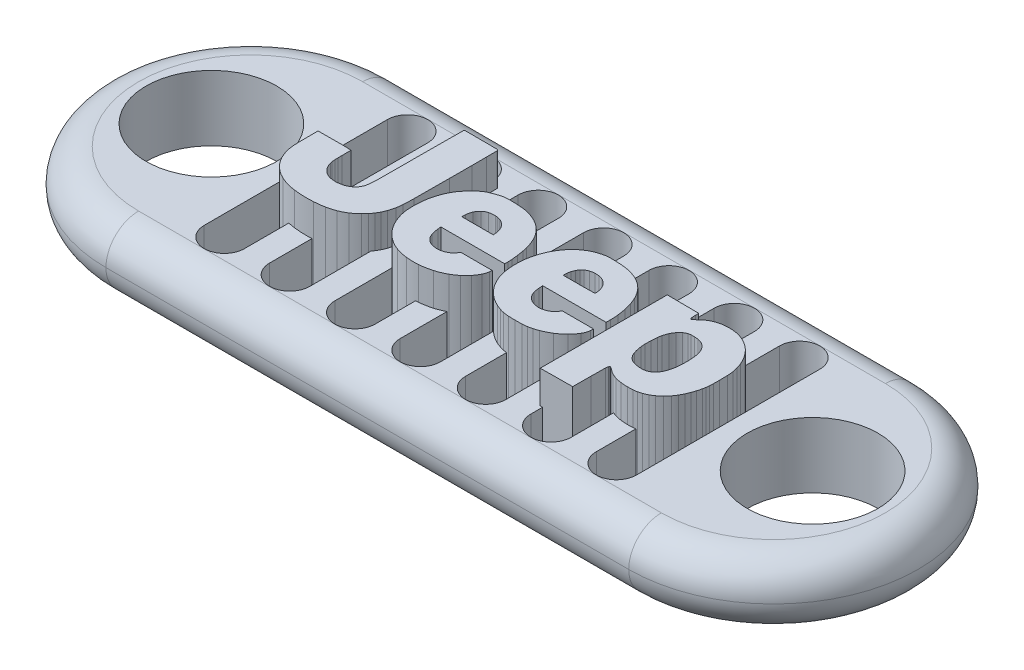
SolidWorks part; units mm, degrees
ref_plane "Front Plane" through (0, 0, 0) normal (0, 0, 1) x (1, 0, 0)
ref_plane "Top Plane" through (0, 0, 0) normal (0, 1, 0) x (1, 0, 0)
ref_plane "Right Plane" through (0, 0, 0) normal (1, 0, 0) x (0, 0, -1)
sketch "Sketch2" plane through (0, 0, 0) normal (0, 1, 0) x (1, 0, 0)
  line L0 (7.1989, 14.0654) -> (7.189, 13.0274)
  line L1 (4.2006, 7.7862) -> (4.2, 8.4725)
  line L2 (4.2, 8.4725) -> (4.01, 8.4933)
  line L3 (2.74, 8.507) -> (1.66, 8.5)
  line L4 (1.66, 8.5) -> (1.6621, 7.5)
  line L5 (9.8308, 13.2169) -> (9.8236, 14.0403)
  line L6 (17.5483, 5.7274) -> (17.5711, 5.92)
  line L7 (17.5711, 5.92) -> (16.371, 5.92)
  line L8 (16.371, 5.92) -> (15.1709, 5.92)
  line L9 (15.1709, 5.92) -> (15.0609, 5.7613)
  line L10 (12.7418, 6.59) -> (12.716, 6.84)
  line L11 (12.716, 6.84) -> (15.158, 6.84)
  line L12 (15.158, 6.84) -> (17.6, 6.84)
  line L13 (17.6, 6.84) -> (17.6, 7.0884)
  line L14 (15.2255, 8.5678) -> (15.2514, 8.32)
  line L15 (15.2514, 8.32) -> (14.0403, 8.32)
  line L16 (14.0403, 8.32) -> (12.8293, 8.32)
  line L17 (12.8293, 8.32) -> (12.8492, 8.5985)
  line L18 (25.3087, 5.7017) -> (25.3312, 5.92)
  line L19 (25.3312, 5.92) -> (24.1309, 5.92)
  line L20 (24.1309, 5.92) -> (22.9306, 5.92)
  line L21 (22.9306, 5.92) -> (22.8245, 5.7597)
  line L22 (20.5304, 6.53) -> (20.5086, 6.84)
  line L23 (20.5086, 6.84) -> (22.9343, 6.84)
  line L24 (22.9343, 6.84) -> (25.36, 6.84)
  line L25 (25.36, 6.84) -> (25.3592, 7.17)
  line L26 (22.9924, 8.3378) -> (22.6472, 8.3288)
  line L27 (21.7922, 8.32) -> (20.589, 8.32)
  line L28 (20.589, 8.32) -> (20.6101, 8.5821)
  line L29 (28.3102, 10.72) -> (28.3, 10.98)
  line L30 (28.3, 10.98) -> (27.09, 10.9906)
  line L31 (27.09, 10.9906) -> (25.88, 11.0012)
  line L32 (25.88, 11.0012) -> (25.88, 6.14)
  line L33 (25.88, 6.14) -> (25.88, 1.2788)
  line L34 (25.88, 1.2788) -> (27.11, 1.2894)
  line L35 (27.11, 1.2894) -> (28.34, 1.3)
  line L36 (28.34, 1.3) -> (28.3505, 2.69)
  arc A0 (7.2104, 14.1047) -> (7.1989, 14.0654) centre (7.2747, 14.0646) ccw
  arc A1 (7.189, 13.0274) -> (7.1809, 11.8681) centre (250.312, 10.7468) ccw
  arc A2 (7.1809, 11.8681) -> (7.1766, 10.5) centre (477.0051, 9.7009) ccw
  arc A3 (7.1686, 7.8738) -> (7.1766, 10.5) centre (-981.6143, 12.1817) ccw
  arc A4 (7.1431, 7.0983) -> (7.1686, 7.8738) centre (-6.4614, 7.9332) ccw
  arc A5 (7.0741, 6.6846) -> (7.1431, 7.0983) centre (5.129, 7.2219) ccw
  arc A6 (6.9231, 6.3707) -> (7.0741, 6.6846) centre (6.1296, 6.9455) ccw
  arc A7 (6.7206, 6.1526) -> (6.9231, 6.3707) centre (5.9288, 7.091) ccw
  arc A8 (6.4704, 5.9881) -> (6.7206, 6.1526) centre (5.9103, 7.1129) ccw
  arc A9 (6.1674, 5.8764) -> (6.4704, 5.9881) centre (5.8079, 7.3185) ccw
  arc A10 (5.8077, 5.8153) -> (6.1674, 5.8764) centre (5.5848, 8.2134) ccw
  arc A11 (5.2709, 5.8503) -> (5.8077, 5.8153) centre (5.6494, 7.5188) ccw
  arc A12 (4.806, 6.0527) -> (5.2709, 5.8503) centre (5.5716, 7.1757) ccw
  arc A13 (4.4574, 6.4056) -> (4.806, 6.0527) centre (5.5342, 7.121) ccw
  arc A14 (4.2544, 6.8741) -> (4.4574, 6.4056) centre (5.661, 7.2052) ccw
  arc A15 (4.2319, 7.0101) -> (4.2544, 6.8741) centre (5.2601, 7.1108) ccw
  arc A16 (4.2152, 7.2223) -> (4.2319, 7.0101) centre (9.7062, 7.5462) ccw
  arc A17 (4.2044, 7.4842) -> (4.2152, 7.2223) centre (11.6842, 7.6628) ccw
  arc A18 (4.2006, 7.7862) -> (4.2044, 7.4842) centre (17.3536, 7.7982) ccw
  arc A19 (4.01, 8.4933) -> (3.8862, 8.5011) centre (3.8615, 7.1337) ccw
  arc A20 (3.8862, 8.5011) -> (3.5586, 8.5059) centre (3.0695, -36.6513) ccw
  arc A21 (3.5586, 8.5059) -> (3.1675, 8.5082) centre (3.1266, -31.3811) ccw
  arc A22 (3.1675, 8.5082) -> (2.74, 8.507) centre (3.1091, -48.4008) ccw
  arc A23 (1.6621, 7.5) -> (1.6747, 6.7835) centre (24.9895, 7.5495) ccw
  arc A24 (1.6747, 6.7835) -> (1.7148, 6.3282) centre (5.8159, 6.9196) ccw
  arc A25 (1.7148, 6.3282) -> (1.7972, 5.9573) centre (4.2165, 6.6889) ccw
  arc A26 (1.7972, 5.9573) -> (1.9431, 5.5513) centre (5.8084, 7.1703) ccw
  arc A27 (1.9431, 5.5513) -> (2.5445, 4.6586) centre (4.4909, 6.6185) ccw
  arc A28 (2.5445, 4.6586) -> (3.4603, 4.0269) centre (4.7558, 6.8852) ccw
  arc A29 (3.4603, 4.0269) -> (4.6767, 3.6842) centre (5.1956, 7.8554) ccw
  arc A30 (4.6767, 3.6842) -> (6.1582, 3.6409) centre (5.6456, 11.4736) ccw
  arc A31 (6.1582, 3.6409) -> (6.9907, 3.7459) centre (5.7022, 10.6092) ccw
  arc A32 (6.9907, 3.7459) -> (7.6832, 3.945) centre (6.2851, 7.5044) ccw
  arc A33 (7.6832, 3.945) -> (8.275, 4.2519) centre (6.5112, 6.9286) ccw
  arc A34 (8.275, 4.2519) -> (8.8035, 4.68) centre (6.3657, 7.1494) ccw
  arc A35 (8.8035, 4.68) -> (9.0649, 4.9635) centre (5.9225, 7.5984) ccw
  arc A36 (9.0649, 4.9635) -> (9.2759, 5.2485) centre (6.8137, 6.8512) ccw
  arc A37 (9.2759, 5.2485) -> (9.445, 5.5478) centre (6.9753, 6.7459) ccw
  arc A38 (9.445, 5.5478) -> (9.5806, 5.8739) centre (6.6945, 6.8822) ccw
  arc A39 (9.5806, 5.8739) -> (9.7229, 6.3852) centre (5.7043, 7.2281) ccw
  arc A40 (9.7229, 6.3852) -> (9.7886, 6.8842) centre (6.473, 7.0669) ccw
  arc A41 (9.7886, 6.8842) -> (9.8139, 7.7027) centre (-7.1419, 7.8173) ccw
  arc A42 (9.8139, 7.7027) -> (9.8287, 10.3757) centre (-1087.4737, 15.1221) ccw
  arc A43 (9.8287, 10.3757) -> (9.834, 12.1155) centre (-670.8311, 13.3211) ccw
  arc A44 (9.834, 12.1155) -> (9.8308, 13.2169) centre (-107.635, 12.3238) ccw
  arc A45 (9.8236, 14.0403) -> (9.8004, 14.0956) centre (9.7443, 14.0395) ccw
  arc A46 (9.8004, 14.0956) -> (9.6933, 14.1404) centre (9.6922, 13.9874) ccw
  arc A47 (9.6933, 14.1404) -> (8.4964, 14.1469) centre (7.4182, -294.0203) ccw
  arc A48 (8.4964, 14.1469) -> (7.2905, 14.1492) centre (7.1906, -358.9684) ccw
  arc A49 (7.2905, 14.1492) -> (7.2104, 14.1047) centre (7.2905, 14.0549) ccw
  arc A50 (13.1619, 11.2374) -> (12.8973, 11.175) centre (13.6026, 8.7799) ccw
  arc A51 (12.8973, 11.175) -> (12.5834, 11.072) centre (14.4234, 5.9921) ccw
  arc A52 (12.5834, 11.072) -> (12.28, 10.9515) centre (14.4006, 6.0553) ccw
  arc A53 (12.28, 10.9515) -> (12.0498, 10.8346) centre (13.1203, 9.0112) ccw
  arc A54 (12.0498, 10.8346) -> (11.7703, 10.6326) centre (12.9708, 9.2659) ccw
  arc A55 (11.7703, 10.6326) -> (11.4368, 10.3146) centre (15.4991, 6.3875) ccw
  arc A56 (11.4368, 10.3146) -> (11.1235, 9.9628) centre (15.5736, 6.3155) ccw
  arc A57 (11.1235, 9.9628) -> (10.9043, 9.6497) centre (13.0733, 8.3647) ccw
  arc A58 (10.9043, 9.6497) -> (10.63, 9.1024) centre (14.662, 7.4236) ccw
  arc A59 (10.63, 9.1024) -> (10.4337, 8.5202) centre (14.7236, 7.398) ccw
  arc A60 (10.4337, 8.5202) -> (10.3156, 7.901) centre (14.9588, 7.3364) ccw
  arc A61 (10.3156, 7.901) -> (10.2749, 7.2434) centre (15.8503, 7.228) ccw
  arc A62 (10.2749, 7.2434) -> (10.2776, 7.0158) centre (17.8728, 7.2225) ccw
  arc A63 (10.2776, 7.0158) -> (10.2872, 6.7836) centre (18.5332, 7.2404) ccw
  arc A64 (10.2872, 6.7836) -> (10.3015, 6.5779) centre (17.6169, 7.1896) ccw
  arc A65 (10.3015, 6.5779) -> (10.3191, 6.445) centre (11.6943, 6.6944) ccw
  arc A66 (10.3191, 6.445) -> (10.5979, 5.538) centre (14.2575, 7.1592) ccw
  arc A67 (10.5979, 5.538) -> (11.0763, 4.7536) centre (13.8215, 6.966) ccw
  arc A68 (11.0763, 4.7536) -> (11.7281, 4.1363) centre (13.6881, 6.8585) ccw
  arc A69 (11.7281, 4.1363) -> (12.5159, 3.7191) centre (13.6345, 6.7841) ccw
  arc A70 (12.5159, 3.7191) -> (13.3999, 3.5094) centre (13.8504, 7.3756) ccw
  arc A71 (13.3999, 3.5094) -> (14.3622, 3.4926) centre (13.9656, 8.3644) ccw
  arc A72 (14.3622, 3.4926) -> (15.3106, 3.6649) centre (13.9644, 8.3793) ccw
  arc A73 (15.3106, 3.6649) -> (16.1535, 4.0152) centre (14.2252, 7.466) ccw
  arc A74 (16.1535, 4.0152) -> (16.6768, 4.3728) centre (14.4299, 7.0996) ccw
  arc A75 (16.6768, 4.3728) -> (17.1093, 4.8076) centre (14.7039, 6.7672) ccw
  arc A76 (17.1093, 4.8076) -> (17.4121, 5.2746) centre (15.1146, 6.4325) ccw
  arc A77 (17.4121, 5.2746) -> (17.5483, 5.7274) centre (16.196, 5.8875) ccw
  arc A78 (14.8491, 5.533) -> (15.0609, 5.7613) centre (14.156, 6.3884) ccw
  arc A79 (14.5746, 5.3635) -> (14.8491, 5.533) centre (14.0524, 6.5162) ccw
  arc A80 (14.2597, 5.2659) -> (14.5746, 5.3635) centre (14.0281, 6.5698) ccw
  arc A81 (13.9293, 5.2486) -> (14.2597, 5.2659) centre (14.0251, 6.5869) ccw
  arc A82 (13.4496, 5.3609) -> (13.9293, 5.2486) centre (14.0407, 6.8058) ccw
  arc A83 (13.0962, 5.6117) -> (13.4496, 5.3609) centre (13.8112, 6.2448) ccw
  arc A84 (12.8636, 6.0175) -> (13.0962, 5.6117) centre (13.9598, 6.3764) ccw
  arc A85 (12.7418, 6.59) -> (12.8636, 6.0175) centre (15.473, 6.8717) ccw
  arc A86 (17.6, 7.0884) -> (17.5834, 7.4317) centre (14.0423, 7.0884) ccw
  arc A87 (17.5834, 7.4317) -> (17.5284, 7.9074) centre (4.6546, 6.1783) ccw
  arc A88 (17.5284, 7.9074) -> (17.4549, 8.3866) centre (4.629, 6.1749) ccw
  arc A89 (17.4549, 8.3866) -> (17.3773, 8.7465) centre (13.1046, 7.6364) ccw
  arc A90 (17.3773, 8.7465) -> (17.0295, 9.6448) centre (13.3221, 7.6929) ccw
  arc A91 (17.0295, 9.6448) -> (16.5094, 10.3454) centre (14.512, 8.3194) ccw
  arc A92 (16.5094, 10.3454) -> (15.8083, 10.848) centre (14.5649, 8.373) ccw
  arc A93 (15.8083, 10.848) -> (14.927, 11.1621) centre (14.0994, 7.4465) ccw
  arc A94 (14.927, 11.1621) -> (14.5522, 11.2204) centre (14.2891, 8.2983) ccw
  arc A95 (14.5522, 11.2204) -> (14.0156, 11.256) centre (13.5287, -0.1487) ccw
  arc A96 (14.0156, 11.256) -> (13.487, 11.2667) centre (13.5134, -0.5075) ccw
  arc A97 (13.487, 11.2667) -> (13.1619, 11.2374) centre (13.4912, 9.4008) ccw
  arc A98 (14.7889, 9.4052) -> (14.5275, 9.5659) centre (14.1033, 8.5826) ccw
  arc A99 (15.0021, 9.1732) -> (14.7889, 9.4052) centre (14.0273, 8.4914) ccw
  arc A100 (15.1515, 8.887) -> (15.0021, 9.1732) centre (13.9765, 8.4559) ccw
  arc A101 (15.2255, 8.5678) -> (15.1515, 8.887) centre (13.9053, 8.4298) ccw
  arc A102 (12.9612, 9.0617) -> (12.8492, 8.5985) centre (14.2883, 8.4955) ccw
  arc A103 (13.2133, 9.4104) -> (12.9612, 9.0617) centre (13.8569, 8.6795) ccw
  arc A104 (13.5899, 9.6151) -> (13.2133, 9.4104) centre (13.8512, 8.686) ccw
  arc A105 (14.06, 9.6647) -> (13.5899, 9.6151) centre (13.9702, 8.2628) ccw
  arc A106 (14.181, 9.6519) -> (14.06, 9.6647) centre (13.9657, 8.1932) ccw
  arc A107 (14.3128, 9.6283) -> (14.181, 9.6519) centre (13.8648, 7.5089) ccw
  arc A108 (14.4358, 9.5982) -> (14.3128, 9.6283) centre (13.8958, 7.6557) ccw
  arc A109 (14.5275, 9.5659) -> (14.4358, 9.5982) centre (14.2445, 8.9098) ccw
  arc A110 (20.9266, 11.238) -> (20.1553, 11.0011) centre (21.5212, 7.9293) ccw
  arc A111 (20.1553, 11.0011) -> (19.4846, 10.5913) centre (21.3875, 8.23) ccw
  arc A112 (19.4846, 10.5913) -> (18.9239, 10.0095) centre (21.5079, 8.0805) ccw
  arc A113 (18.9239, 10.0095) -> (18.4776, 9.2645) centre (22.3574, 7.4464) ccw
  arc A114 (18.4776, 9.2645) -> (18.2819, 8.7757) centre (22.6335, 7.317) ccw
  arc A115 (18.2819, 8.7757) -> (18.1459, 8.273) centre (22.4487, 7.379) ccw
  arc A116 (18.1459, 8.273) -> (18.0664, 7.7395) centre (22.7837, 7.3094) ccw
  arc A117 (18.0664, 7.7395) -> (18.04, 7.1584) centre (24.4395, 7.1584) ccw
  arc A118 (18.04, 7.1584) -> (18.1753, 6.0867) centre (22.3513, 7.1584) ccw
  arc A119 (18.1753, 6.0867) -> (18.5723, 5.1399) centre (21.5971, 6.9648) ccw
  arc A120 (18.5723, 5.1399) -> (19.2115, 4.3708) centre (21.4259, 6.8616) ccw
  arc A121 (19.2115, 4.3708) -> (20.0551, 3.8184) centre (21.4993, 6.9441) ccw
  arc A122 (20.0551, 3.8184) -> (20.4487, 3.6591) centre (21.904, 7.8201) ccw
  arc A123 (20.4487, 3.6591) -> (20.8016, 3.5648) centre (21.2505, 5.9516) ccw
  arc A124 (20.8016, 3.5648) -> (21.1986, 3.5167) centre (21.367, 6.5708) ccw
  arc A125 (21.1986, 3.5167) -> (21.74, 3.5015) centre (21.75, 13.5192) ccw
  arc A126 (21.74, 3.5015) -> (22.2573, 3.5125) centre (21.7516, 15.175) ccw
  arc A127 (22.2573, 3.5125) -> (22.6374, 3.5495) centre (22.1035, 7.0606) ccw
  arc A128 (22.6374, 3.5495) -> (22.9758, 3.6229) centre (22.2204, 6.2917) ccw
  arc A129 (22.9758, 3.6229) -> (23.3535, 3.7469) centre (21.6698, 8.237) ccw
  arc A130 (23.3535, 3.7469) -> (24.0723, 4.1056) centre (21.9963, 7.3661) ccw
  arc A131 (24.0723, 4.1056) -> (24.6889, 4.6003) centre (22.1239, 7.1657) ccw
  arc A132 (24.6889, 4.6003) -> (25.1261, 5.1577) centre (22.6033, 6.6862) ccw
  arc A133 (25.1261, 5.1577) -> (25.3087, 5.7017) centre (24.0065, 5.8361) ccw
  arc A134 (22.6374, 5.549) -> (22.8245, 5.7597) centre (21.992, 6.3107) ccw
  arc A135 (22.3871, 5.383) -> (22.6374, 5.549) centre (21.8085, 6.5272) ccw
  arc A136 (22.0981, 5.2762) -> (22.3871, 5.383) centre (21.7779, 6.5876) ccw
  arc A137 (21.797, 5.24) -> (22.0981, 5.2762) centre (21.797, 6.5097) ccw
  arc A138 (21.7059, 5.2457) -> (21.797, 5.24) centre (21.797, 5.9656) ccw
  arc A139 (21.5851, 5.2643) -> (21.7059, 5.2457) centre (21.9924, 7.5108) ccw
  arc A140 (21.4568, 5.2911) -> (21.5851, 5.2643) centre (22.0284, 7.7092) ccw
  arc A141 (21.3404, 5.3228) -> (21.4568, 5.2911) centre (21.8685, 7.0326) ccw
  arc A142 (21.0128, 5.4854) -> (21.3404, 5.3228) centre (21.6765, 6.4112) ccw
  arc A143 (20.7672, 5.7388) -> (21.0128, 5.4854) centre (21.5905, 6.2912) ccw
  arc A144 (20.6068, 6.0873) -> (20.7672, 5.7388) centre (21.7685, 6.4106) ccw
  arc A145 (20.5304, 6.53) -> (20.6068, 6.0873) centre (22.7627, 6.6873) ccw
  arc A146 (25.3592, 7.17) -> (25.3246, 7.7853) centre (19.6274, 7.1564) ccw
  arc A147 (25.3246, 7.7853) -> (25.2241, 8.405) centre (19.1887, 7.108) ccw
  arc A148 (25.2241, 8.405) -> (25.0654, 8.9925) centre (19.5279, 7.1809) ccw
  arc A149 (25.0654, 8.9925) -> (24.8562, 9.511) centre (21.1143, 7.6999) ccw
  arc A150 (24.8562, 9.511) -> (24.4759, 10.1211) centre (21.8143, 8.0387) ccw
  arc A151 (24.4759, 10.1211) -> (23.9958, 10.5942) centre (22.4103, 8.5049) ccw
  arc A152 (23.9958, 10.5942) -> (23.4009, 10.9375) centre (22.3413, 8.4141) ccw
  arc A153 (23.4009, 10.9375) -> (22.6802, 11.1623) centre (21.8617, 7.272) ccw
  arc A154 (22.6802, 11.1623) -> (22.2898, 11.2213) centre (21.9741, 7.8063) ccw
  arc A155 (22.2898, 11.2213) -> (21.7623, 11.257) centre (21.2976, 0.4878) ccw
  arc A156 (21.7623, 11.257) -> (21.2479, 11.2672) centre (21.2855, 0.2072) ccw
  arc A157 (21.2479, 11.2672) -> (20.9266, 11.238) centre (21.2542, 9.4149) ccw
  arc A158 (22.584, 9.3827) -> (22.3431, 9.5402) centre (21.8324, 8.4964) ccw
  arc A159 (22.7765, 9.1719) -> (22.584, 9.3827) centre (21.8565, 8.5248) ccw
  arc A160 (22.9145, 8.9131) -> (22.7765, 9.1719) centre (21.8003, 8.4853) ccw
  arc A161 (22.9946, 8.6139) -> (22.9145, 8.9131) centre (21.5339, 8.383) ccw
  arc A162 (23.0075, 8.5221) -> (22.9946, 8.6139) centre (20.4172, 8.2066) ccw
  arc A163 (23.0154, 8.4399) -> (23.0075, 8.5221) centre (21.3706, 8.3227) ccw
  arc A164 (23.0191, 8.3717) -> (23.0154, 8.4399) centre (21.0658, 8.301) ccw
  arc A165 (23.0134, 8.35) -> (23.0191, 8.3717) centre (22.9799, 8.3703) ccw
  arc A166 (22.9924, 8.3378) -> (23.0134, 8.35) centre (22.9917, 8.3632) ccw
  arc A167 (22.2547, 8.3222) -> (22.6472, 8.3288) centre (22.0139, 34.1109) ccw
  arc A168 (21.7922, 8.32) -> (22.2547, 8.3222) centre (21.7922, 57.847) ccw
  arc A169 (20.6569, 8.8437) -> (20.6101, 8.5821) centre (21.9786, 8.4723) ccw
  arc A170 (20.7538, 9.0972) -> (20.6569, 8.8437) centre (22.0915, 8.4406) ccw
  arc A171 (20.8868, 9.3129) -> (20.7538, 9.0972) centre (21.9359, 8.517) ccw
  arc A172 (21.0414, 9.461) -> (20.8868, 9.3129) centre (21.4293, 8.9013) ccw
  arc A173 (21.331, 9.6026) -> (21.0414, 9.461) centre (21.651, 8.5814) ccw
  arc A174 (21.6727, 9.6656) -> (21.331, 9.6026) centre (21.7598, 8.234) ccw
  arc A175 (22.0242, 9.6448) -> (21.6727, 9.6656) centre (21.7622, 8.1947) ccw
  arc A176 (22.3431, 9.5402) -> (22.0242, 9.6448) centre (21.8076, 8.4456) ccw
  arc A177 (30.0216, 11.1555) -> (29.6294, 11.071) centre (30.4501, 8.2139) ccw
  arc A178 (29.6294, 11.071) -> (29.2869, 10.9391) centre (30.2066, 9.0619) ccw
  arc A179 (29.2869, 10.9391) -> (28.976, 10.7508) centre (30.1861, 9.1035) ccw
  arc A180 (28.976, 10.7508) -> (28.6788, 10.4977) centre (30.5832, 8.563) ccw
  arc A181 (28.5906, 10.4143) -> (28.6788, 10.4977) centre (26.5721, 12.638) ccw
  arc A182 (28.5085, 10.3439) -> (28.5906, 10.4143) centre (27.3186, 11.8156) ccw
  arc A183 (28.4382, 10.2895) -> (28.5085, 10.3439) centre (27.158, 12.0142) ccw
  arc A184 (28.4096, 10.28) -> (28.4382, 10.2895) centre (28.4096, 10.328) ccw
  arc A185 (28.3696, 10.3037) -> (28.4096, 10.28) centre (28.4096, 10.3255) ccw
  arc A186 (28.3419, 10.3773) -> (28.3696, 10.3037) centre (28.6196, 10.4401) ccw
  arc A187 (28.3225, 10.5063) -> (28.3419, 10.3773) centre (29.2111, 10.5736) ccw
  arc A188 (28.3102, 10.72) -> (28.3225, 10.5063) centre (34.2064, 10.952) ccw
  arc A189 (28.3622, 3.7777) -> (28.3505, 2.69) centre (199.4795, 1.3949) ccw
  arc A190 (28.3963, 4.0087) -> (28.3622, 3.7777) centre (29.2468, 3.7653) ccw
  arc A191 (28.4899, 4.0504) -> (28.3963, 4.0087) centre (28.4606, 3.9903) ccw
  arc A192 (28.7007, 3.9139) -> (28.4899, 4.0504) centre (28.0303, 3.1094) ccw
  arc A193 (28.7007, 3.9139) -> (29.0511, 3.6791) centre (29.9999, 5.473) ccw
  arc A194 (29.0511, 3.6791) -> (29.4507, 3.515) centre (30.0934, 5.6497) ccw
  arc A195 (29.4507, 3.515) -> (29.915, 3.4181) centre (30.2405, 6.1384) ccw
  arc A196 (29.915, 3.4181) -> (30.46, 3.3843) centre (30.4835, 8.1697) ccw
  arc A197 (30.46, 3.3843) -> (30.8641, 3.3963) centre (30.4886, 9.2193) ccw
  arc A198 (30.8641, 3.3963) -> (31.1741, 3.4393) centre (30.7268, 5.5256) ccw
  arc A199 (31.1741, 3.4393) -> (31.4635, 3.5253) centre (30.7663, 5.3417) ccw
  arc A200 (31.4635, 3.5253) -> (31.8, 3.6716) centre (29.9553, 7.4544) ccw
  arc A201 (31.8, 3.6716) -> (32.1099, 3.8635) centre (31.0062, 5.2993) ccw
  arc A202 (32.1099, 3.8635) -> (32.4393, 4.1494) centre (29.8684, 6.7795) ccw
  arc A203 (32.4393, 4.1494) -> (32.7378, 4.4777) centre (29.8026, 6.8468) ccw
  arc A204 (32.7378, 4.4777) -> (32.9544, 4.8) centre (31.0087, 5.8734) ccw
  arc A205 (32.9544, 4.8) -> (33.1123, 5.1125) centre (28.7167, 7.1378) ccw
  arc A206 (33.1123, 5.1125) -> (33.2484, 5.4377) centre (28.5949, 7.1939) ccw
  arc A207 (33.2484, 5.4377) -> (33.3615, 5.7727) centre (28.5655, 7.205) ccw
  arc A208 (33.3615, 5.7727) -> (33.4506, 6.1147) centre (28.5774, 7.2015) ccw
  arc A209 (33.4506, 6.1147) -> (33.4954, 6.3541) centre (29.9644, 6.8922) ccw
  arc A210 (33.4954, 6.3541) -> (33.5209, 6.5831) centre (30.6648, 6.7854) ccw
  arc A211 (33.5209, 6.5831) -> (33.5335, 6.8738) centre (28.2601, 6.9558) ccw
  arc A212 (33.5335, 6.8738) -> (33.5374, 7.34) centre (1.3645, 7.3741) ccw
  arc A213 (33.5374, 7.34) -> (33.5236, 7.9743) centre (19.6169, 7.3548) ccw
  arc A214 (33.5236, 7.9743) -> (33.4769, 8.4402) centre (29.2899, 7.7857) ccw
  arc A215 (33.4769, 8.4402) -> (33.3864, 8.8411) centre (30.4457, 7.9664) ccw
  arc A216 (33.3864, 8.8411) -> (33.2371, 9.2608) centre (29.3323, 7.6352) ccw
  arc A217 (33.2371, 9.2608) -> (32.6996, 10.1421) centre (30.1141, 7.9607) ccw
  arc A218 (32.6996, 10.1421) -> (31.9365, 10.7864) centre (30.427, 8.2246) ccw
  arc A219 (31.9365, 10.7864) -> (31.0158, 11.1336) centre (30.4762, 8.3082) ccw
  arc A220 (31.0158, 11.1336) -> (30.0216, 11.1555) centre (30.4536, 8.1899) ccw
  arc A221 (30.5878, 8.9478) -> (30.2053, 9.1806) centre (29.8493, 8.1651) ccw
  arc A222 (30.8539, 8.5742) -> (30.5878, 8.9478) centre (29.7774, 8.089) ccw
  arc A223 (31.0071, 8.0342) -> (30.8539, 8.5742) centre (29.1073, 7.7869) ccw
  arc A224 (31.053, 7.3) -> (31.0071, 8.0342) centre (25.5624, 7.3256) ccw
  arc A225 (31.0192, 6.6478) -> (31.053, 7.3) centre (24.1225, 7.3324) ccw
  arc A226 (30.9211, 6.1273) -> (31.0192, 6.6478) centre (27.9971, 6.9478) ccw
  arc A227 (30.7566, 5.7182) -> (30.9211, 6.1273) centre (28.9638, 6.6765) ccw
  arc A228 (30.5215, 5.4061) -> (30.7566, 5.7182) centre (29.6387, 6.3158) ccw
  arc A229 (30.339, 5.264) -> (30.5215, 5.4061) centre (29.7784, 6.1718) ccw
  arc A230 (30.1403, 5.1743) -> (30.339, 5.264) centre (29.8953, 5.9825) ccw
  arc A231 (29.9039, 5.131) -> (30.1403, 5.1743) centre (29.831, 6.1945) ccw
  arc A232 (29.6056, 5.1284) -> (29.9039, 5.131) centre (29.7336, 7.6166) ccw
  arc A233 (29.0784, 5.2345) -> (29.6056, 5.1284) centre (29.6998, 6.9594) ccw
  arc A234 (28.7023, 5.4852) -> (29.0784, 5.2345) centre (29.3979, 6.1214) ccw
  arc A235 (28.455, 5.909) -> (28.7023, 5.4852) centre (29.5598, 6.2695) ccw
  arc A236 (28.3146, 6.54) -> (28.455, 5.909) centre (31.6486, 6.9511) ccw
  arc A237 (28.2895, 6.9043) -> (28.3146, 6.54) centre (31.6739, 6.9542) ccw
  arc A238 (28.2958, 7.3568) -> (28.2895, 6.9043) centre (36.1863, 7.0207) ccw
  arc A239 (28.3268, 7.7946) -> (28.2958, 7.3568) centre (36.0636, 7.026) ccw
  arc A240 (28.3811, 8.1025) -> (28.3268, 7.7946) centre (30.3901, 7.5896) ccw
  arc A241 (28.5204, 8.499) -> (28.3811, 8.1025) centre (30.7021, 7.51) ccw
  arc A242 (28.7182, 8.8295) -> (28.5204, 8.499) centre (30.0664, 7.7981) ccw
  arc A243 (28.9617, 9.0751) -> (28.7182, 8.8295) centre (29.7935, 8.0069) ccw
  arc A244 (29.2364, 9.2205) -> (28.9617, 9.0751) centre (29.5102, 8.3708) ccw
  arc A245 (29.437, 9.259) -> (29.2364, 9.2205) centre (29.494, 8.4208) ccw
  arc A246 (29.7061, 9.2626) -> (29.437, 9.259) centre (29.6048, 6.7953) ccw
  arc A247 (29.9817, 9.2362) -> (29.7061, 9.2626) centre (29.6018, 6.7225) ccw
  arc A248 (30.2053, 9.1806) -> (29.9817, 9.2362) centre (29.7975, 8.0175) ccw
extrude "Boss-Extrude1" add sketch "Sketch2" along normal blind 2.5
sketch "Sketch3" plane through (0, 0, 0) normal (0, -1, 0) x (1, 0, 0)
  line L0 (1.6656, -7.1417) -> (33.5341, -7.6572) construction
  line L1 (-2.4001, -7.3995) -> (37.5999, -7.3995) construction
  line L2 (-2.4001, 3.6706) -> (37.5999, 3.6706)
  line L3 (-2.4001, -18.4695) -> (37.5999, -18.4695)
  line L4 (0, 0) -> (7.3825, 0) construction
  line L5 (17.5999, -14.4097) -> (17.5999, -0.3893) construction
  line L6 (16.057, -14.4097) -> (16.057, -10.7065)
  line L7 (19.1428, -14.4097) -> (19.1428, -10.2724)
  line L8 (24.1428, -14.4097) -> (24.1428, -10.474)
  line L9 (21.057, -14.4097) -> (21.057, -11.2567)
  line L10 (22.5999, -14.4097) -> (22.5999, -0.3893) construction
  line L11 (29.1428, -14.4097) -> (29.1428, -10.8612)
  line L12 (26.057, -14.4097) -> (26.057, -10.9996)
  line L13 (27.5999, -14.4097) -> (27.5999, -0.3893) construction
  line L14 (34.1428, -14.4097) -> (34.1428, -0.3893)
  line L15 (31.057, -14.4097) -> (31.057, -11.1254)
  line L16 (32.5999, -14.4097) -> (32.5999, -0.3893) construction
  line L17 (12.5999, -14.4097) -> (12.5999, -0.3893) construction
  line L18 (11.057, -14.4097) -> (11.057, -9.878)
  line L19 (14.1428, -14.4097) -> (14.1428, -11.2499)
  line L20 (7.5999, -14.4097) -> (7.5999, -0.3893) construction
  line L21 (6.057, -14.4097) -> (6.057, -5.8516)
  line L22 (9.1428, -14.4097) -> (9.1428, -14.144)
  line L23 (2.5999, -14.4097) -> (2.5999, -0.3893) construction
  line L24 (1.057, -14.4097) -> (1.057, -0.3893)
  line L25 (4.1428, -14.4097) -> (4.1428, -8.4787)
  line L26 (28.3102, -10.72) -> (28.3, -10.98) construction
  line L27 (28.3, -10.98) -> (25.88, -11.0012) construction
  line L29 (4.1428, -3.786) -> (4.1428, -0.3893)
  line L30 (6.057, -3.6349) -> (6.057, -0.3893)
  line L31 (9.1428, -5.0605) -> (9.1428, -0.3893)
  line L32 (7.189, -13.0274) -> (7.1989, -14.0654)
  line L33 (4.2, -8.4725) -> (4.2006, -7.7862)
  line L34 (4.01, -8.4933) -> (4.2, -8.4725)
  line L35 (1.66, -8.5) -> (2.74, -8.507)
  line L36 (1.6621, -7.5) -> (1.66, -8.5)
  line L37 (9.8236, -14.0402) -> (9.8308, -13.2169)
  line L38 (7.189, -13.0274) -> (7.1989, -14.0654)
  line L40 (4.01, -8.4933) -> (4.1428, -8.4787)
  line L41 (1.66, -8.5) -> (2.74, -8.507)
  line L42 (1.6621, -7.5) -> (1.66, -8.5)
  line L44 (25.88, -1.2788) -> (28.34, -1.3) construction
  line L45 (28.34, -1.3) -> (28.3505, -2.69) construction
  line L47 (25.3312, -5.92) -> (22.9306, -5.92) construction
  line L48 (22.9306, -5.92) -> (22.8245, -5.7597) construction
  line L50 (20.5086, -6.84) -> (25.36, -6.84) construction
  line L51 (11.057, -4.7778) -> (11.057, -0.3893)
  line L52 (16.057, -6.84) -> (16.057, -5.92)
  line L53 (16.057, -6.84) -> (17.6, -6.84)
  line L54 (12.8492, -8.5985) -> (12.8293, -8.32) construction
  line L56 (12.8293, -8.32) -> (15.2514, -8.32) construction
  line L57 (12.8492, -8.5985) -> (12.8293, -8.32)
  line L59 (12.8293, -8.32) -> (14.1428, -8.32)
  line L60 (14.1428, -9.6571) -> (14.1428, -8.32)
  line L61 (14.1428, -6.84) -> (14.1428, -5.2504)
  line L62 (16.057, -3.963) -> (16.057, -0.3893)
  line L64 (17.5483, -5.7274) -> (17.5711, -5.92) construction
  line L65 (17.5711, -5.92) -> (15.1709, -5.92) construction
  line L67 (12.7418, -6.59) -> (12.716, -6.84) construction
  line L68 (12.716, -6.84) -> (17.6, -6.84) construction
  line L69 (17.6, -6.84) -> (17.6, -7.0884) construction
  line L70 (28.3102, -10.72) -> (28.3, -10.98)
  line L71 (28.3, -10.98) -> (26.057, -10.9996)
  line L73 (26.057, -1.2804) -> (28.34, -1.3)
  line L74 (28.34, -1.3) -> (28.3505, -2.69)
  line L76 (24.1428, -5.92) -> (22.9306, -5.92)
  line L77 (22.9306, -5.92) -> (22.8245, -5.7597)
  line L79 (21.057, -6.84) -> (24.1428, -6.84)
  line L81 (17.5483, -5.7274) -> (17.5711, -5.92)
  line L82 (17.5711, -5.92) -> (16.057, -5.92)
  line L84 (12.7418, -6.59) -> (12.716, -6.84)
  line L85 (12.716, -6.84) -> (14.1428, -6.84)
  line L86 (17.6, -6.84) -> (17.6, -7.0884)
  line L87 (14.1428, -3.4797) -> (14.1428, -0.3893)
  line L88 (19.1428, -4.4337) -> (19.1428, -0.3893)
  line L89 (21.057, -3.5278) -> (21.057, -0.3893)
  line L90 (24.1428, -4.1516) -> (24.1428, -0.3893)
  line L92 (24.1428, -6.84) -> (24.1428, -5.92)
  line L93 (21.057, -6.84) -> (21.057, -5.4553)
  line L94 (22.6472, -8.3288) -> (22.9924, -8.3378) construction
  line L95 (20.589, -8.32) -> (21.7922, -8.32) construction
  line L97 (22.6472, -8.3288) -> (22.9924, -8.3378)
  line L98 (21.057, -8.32) -> (21.7922, -8.32)
  line L99 (21.057, -9.4716) -> (21.057, -8.32)
  line L100 (29.1428, -9.1844) -> (29.1428, -5.2127)
  line L101 (29.1428, -3.6332) -> (29.1428, -0.3893)
  line L102 (26.057, -1.2804) -> (26.057, -0.3893)
  line L103 (31.057, -3.4176) -> (31.057, -0.3893)
  arc A0 (1.6747, -6.7835) -> (1.6621, -7.5) centre (24.9895, -7.5495) ccw construction
  arc A1 (33.5236, -7.9743) -> (33.5374, -7.34) centre (19.6169, -7.3548) ccw construction
  arc A2 (-2.4001, 3.6706) -> (-2.4001, -18.4695) centre (-2.4001, -7.3995) ccw
  arc A3 (37.5999, -18.4695) -> (37.5999, 3.6706) centre (37.5999, -7.3995) ccw
  circle A4 centre (-5.4001, -7.3995) radius 5
  circle A5 centre (40.5999, -7.3995) radius 5
  arc A6 (16.057, -14.4097) -> (19.1428, -14.4097) centre (17.5999, -14.4097) ccw
  arc A7 (19.1428, -0.3893) -> (16.057, -0.3893) centre (17.5999, -0.3893) ccw
  arc A8 (21.057, -14.4097) -> (24.1428, -14.4097) centre (22.5999, -14.4097) ccw
  arc A9 (24.1428, -0.3893) -> (21.057, -0.3893) centre (22.5999, -0.3893) ccw
  arc A10 (26.057, -14.4097) -> (29.1428, -14.4097) centre (27.5999, -14.4097) ccw
  arc A11 (29.1428, -0.3893) -> (26.057, -0.3893) centre (27.5999, -0.3893) ccw
  arc A12 (31.057, -14.4097) -> (34.1428, -14.4097) centre (32.5999, -14.4097) ccw
  arc A13 (34.1428, -0.3893) -> (31.057, -0.3893) centre (32.5999, -0.3893) ccw
  arc A14 (11.057, -14.4097) -> (14.1428, -14.4097) centre (12.5999, -14.4097) ccw
  arc A15 (14.1428, -0.3893) -> (11.057, -0.3893) centre (12.5999, -0.3893) ccw
  arc A16 (6.057, -14.4097) -> (9.1428, -14.4097) centre (7.5999, -14.4097) ccw
  arc A17 (9.1428, -0.3893) -> (6.057, -0.3893) centre (7.5999, -0.3893) ccw
  arc A18 (1.057, -14.4097) -> (4.1428, -14.4097) centre (2.5999, -14.4097) ccw
  arc A19 (4.1428, -0.3893) -> (1.057, -0.3893) centre (2.5999, -0.3893) ccw
  arc A26 (28.976, -10.7508) -> (29.2869, -10.9391) centre (30.1861, -9.1035) ccw construction
  arc A27 (28.6788, -10.4977) -> (28.976, -10.7508) centre (30.5832, -8.563) ccw construction
  arc A28 (28.6788, -10.4977) -> (28.5906, -10.4143) centre (26.5721, -12.638) ccw construction
  arc A29 (28.5906, -10.4143) -> (28.5085, -10.3439) centre (27.3186, -11.8156) ccw construction
  arc A30 (28.5085, -10.3439) -> (28.4382, -10.2895) centre (27.158, -12.0142) ccw construction
  arc A31 (28.4382, -10.2895) -> (28.4096, -10.28) centre (28.4096, -10.328) ccw construction
  arc A32 (28.4096, -10.28) -> (28.3696, -10.3037) centre (28.4096, -10.3255) ccw construction
  arc A33 (28.3696, -10.3037) -> (28.3419, -10.3773) centre (28.6196, -10.4401) ccw construction
  arc A34 (28.3419, -10.3773) -> (28.3225, -10.5063) centre (29.2111, -10.5736) ccw construction
  arc A35 (28.3225, -10.5063) -> (28.3102, -10.72) centre (34.2064, -10.952) ccw construction
  arc A36 (28.3505, -2.69) -> (28.3622, -3.7777) centre (199.4795, -1.3949) ccw construction
  arc A37 (28.3622, -3.7777) -> (28.3963, -4.0087) centre (29.2468, -3.7653) ccw construction
  arc A38 (28.3963, -4.0087) -> (28.4899, -4.0504) centre (28.4606, -3.9903) ccw construction
  arc A39 (28.4899, -4.0504) -> (28.7007, -3.9139) centre (28.0303, -3.1094) ccw construction
  arc A40 (29.0511, -3.6791) -> (28.7007, -3.9139) centre (29.9999, -5.473) ccw construction
  arc A41 (29.4507, -3.515) -> (29.0511, -3.6791) centre (30.0934, -5.6497) ccw construction
  arc A45 (31.1741, -3.4393) -> (30.8641, -3.3963) centre (30.7268, -5.5256) ccw construction
  arc A46 (31.4635, -3.5253) -> (31.1741, -3.4393) centre (30.7663, -5.3417) ccw construction
  arc A47 (31.8, -3.6716) -> (31.4635, -3.5253) centre (29.9553, -7.4544) ccw construction
  arc A48 (32.1099, -3.8635) -> (31.8, -3.6716) centre (31.0062, -5.2993) ccw construction
  arc A49 (32.4393, -4.1494) -> (32.1099, -3.8635) centre (29.8684, -6.7795) ccw construction
  arc A50 (32.7378, -4.4777) -> (32.4393, -4.1494) centre (29.8026, -6.8468) ccw construction
  arc A51 (32.9544, -4.8) -> (32.7378, -4.4777) centre (31.0087, -5.8734) ccw construction
  arc A52 (33.1123, -5.1125) -> (32.9544, -4.8) centre (28.7167, -7.1378) ccw construction
  arc A53 (33.2484, -5.4377) -> (33.1123, -5.1125) centre (28.5949, -7.1939) ccw construction
  arc A54 (33.3615, -5.7727) -> (33.2484, -5.4377) centre (28.5655, -7.205) ccw construction
  arc A55 (33.4506, -6.1147) -> (33.3615, -5.7727) centre (28.5774, -7.2015) ccw construction
  arc A56 (33.4954, -6.3541) -> (33.4506, -6.1147) centre (29.9644, -6.8922) ccw construction
  arc A57 (33.5209, -6.5831) -> (33.4954, -6.3541) centre (30.6648, -6.7854) ccw construction
  arc A58 (33.5335, -6.8738) -> (33.5209, -6.5831) centre (28.2601, -6.9558) ccw construction
  arc A59 (33.5374, -7.34) -> (33.5335, -6.8738) centre (1.3645, -7.3741) ccw construction
  arc A60 (33.4769, -8.4402) -> (33.5236, -7.9743) centre (29.2899, -7.7857) ccw construction
  arc A61 (33.3864, -8.8411) -> (33.4769, -8.4402) centre (30.4457, -7.9664) ccw construction
  arc A62 (33.2371, -9.2608) -> (33.3864, -8.8411) centre (29.3323, -7.6352) ccw construction
  arc A63 (32.6996, -10.1421) -> (33.2371, -9.2608) centre (30.1141, -7.9607) ccw construction
  arc A64 (31.9365, -10.7864) -> (32.6996, -10.1421) centre (30.427, -8.2246) ccw construction
  arc A65 (31.0158, -11.1336) -> (31.9365, -10.7864) centre (30.4762, -8.3082) ccw construction
  arc A66 (20.9266, -11.238) -> (21.2479, -11.2672) centre (21.2542, -9.4149) ccw construction
  arc A69 (18.9239, -10.0095) -> (19.4846, -10.5913) centre (21.5079, -8.0805) ccw construction
  arc A70 (18.4776, -9.2645) -> (18.9239, -10.0095) centre (22.3574, -7.4464) ccw construction
  arc A71 (18.2819, -8.7757) -> (18.4776, -9.2645) centre (22.6335, -7.317) ccw construction
  arc A72 (18.1459, -8.273) -> (18.2819, -8.7757) centre (22.4487, -7.379) ccw construction
  arc A73 (7.2104, -14.1047) -> (7.2905, -14.1492) centre (7.2905, -14.0549) ccw
  arc A74 (7.1989, -14.0654) -> (7.2104, -14.1047) centre (7.2747, -14.0646) ccw
  arc A75 (7.1809, -11.8681) -> (7.189, -13.0274) centre (250.312, -10.7468) ccw
  arc A76 (7.1766, -10.5) -> (7.1809, -11.8681) centre (477.0051, -9.7009) ccw
  arc A77 (7.1766, -10.5) -> (7.1686, -7.8738) centre (-981.6143, -12.1817) ccw
  arc A78 (7.1686, -7.8738) -> (7.1431, -7.0983) centre (-6.4614, -7.9332) ccw
  arc A79 (7.1431, -7.0983) -> (7.0741, -6.6846) centre (5.129, -7.2219) ccw
  arc A80 (7.0741, -6.6846) -> (6.9231, -6.3707) centre (6.1296, -6.9455) ccw
  arc A81 (6.9231, -6.3707) -> (6.7206, -6.1526) centre (5.9288, -7.091) ccw
  arc A82 (6.7206, -6.1526) -> (6.4704, -5.9881) centre (5.9103, -7.1129) ccw
  arc A83 (6.4704, -5.9881) -> (6.1674, -5.8764) centre (5.8079, -7.3185) ccw
  arc A84 (6.1674, -5.8764) -> (5.8077, -5.8153) centre (5.5848, -8.2134) ccw
  arc A85 (5.8077, -5.8153) -> (5.2709, -5.8503) centre (5.6494, -7.5188) ccw
  arc A86 (5.2709, -5.8503) -> (4.806, -6.0527) centre (5.5716, -7.1757) ccw
  arc A87 (4.806, -6.0527) -> (4.4574, -6.4056) centre (5.5342, -7.121) ccw
  arc A88 (4.4574, -6.4056) -> (4.2544, -6.8741) centre (5.661, -7.2052) ccw
  arc A89 (4.2544, -6.8741) -> (4.2319, -7.0101) centre (5.2601, -7.1108) ccw
  arc A90 (4.2319, -7.0101) -> (4.2152, -7.2223) centre (9.7062, -7.5462) ccw
  arc A91 (4.2152, -7.2223) -> (4.2044, -7.4842) centre (11.6842, -7.6628) ccw
  arc A92 (4.2044, -7.4842) -> (4.2006, -7.7862) centre (17.3536, -7.7982) ccw
  arc A93 (3.8862, -8.5011) -> (4.01, -8.4933) centre (3.8615, -7.1337) ccw
  arc A94 (3.5586, -8.5059) -> (3.8862, -8.5011) centre (3.0695, 36.6513) ccw
  arc A95 (3.1675, -8.5082) -> (3.5586, -8.5059) centre (3.1266, 31.3811) ccw
  arc A96 (2.74, -8.507) -> (3.1675, -8.5082) centre (3.1091, 48.4008) ccw
  arc A97 (1.6747, -6.7835) -> (1.6621, -7.5) centre (24.9895, -7.5495) ccw
  arc A98 (1.7148, -6.3282) -> (1.6747, -6.7835) centre (5.8159, -6.9196) ccw
  arc A99 (1.7972, -5.9573) -> (1.7148, -6.3282) centre (4.2165, -6.6889) ccw
  arc A100 (1.9431, -5.5513) -> (1.7972, -5.9573) centre (5.8084, -7.1703) ccw
  arc A101 (2.5445, -4.6586) -> (1.9431, -5.5513) centre (4.4909, -6.6185) ccw
  arc A102 (3.4603, -4.0269) -> (2.5445, -4.6586) centre (4.7558, -6.8852) ccw
  arc A103 (4.6767, -3.6842) -> (3.4603, -4.0269) centre (5.1956, -7.8554) ccw
  arc A104 (6.1582, -3.6409) -> (4.6767, -3.6842) centre (5.6456, -11.4736) ccw
  arc A105 (6.9907, -3.7459) -> (6.1582, -3.6409) centre (5.7022, -10.6092) ccw
  arc A106 (7.6832, -3.945) -> (6.9907, -3.7459) centre (6.2851, -7.5044) ccw
  arc A107 (8.275, -4.2519) -> (7.6832, -3.945) centre (6.5112, -6.9286) ccw
  arc A108 (8.8035, -4.68) -> (8.275, -4.2519) centre (6.3657, -7.1494) ccw
  arc A109 (9.0649, -4.9635) -> (8.8035, -4.68) centre (5.9225, -7.5984) ccw
  arc A110 (9.2759, -5.2485) -> (9.0649, -4.9635) centre (6.8137, -6.8512) ccw
  arc A111 (9.445, -5.5478) -> (9.2759, -5.2485) centre (6.9753, -6.7459) ccw
  arc A112 (9.5805, -5.8739) -> (9.445, -5.5478) centre (6.6945, -6.8822) ccw
  arc A113 (9.7229, -6.3852) -> (9.5805, -5.8739) centre (5.7043, -7.2281) ccw
  arc A114 (9.7886, -6.8842) -> (9.7229, -6.3852) centre (6.473, -7.0669) ccw
  arc A115 (9.8139, -7.7027) -> (9.7886, -6.8842) centre (-7.1419, -7.8173) ccw
  arc A116 (9.8287, -10.3788) -> (9.8139, -7.7027) centre (-1087.4737, -15.1221) ccw
  arc A117 (9.834, -12.1157) -> (9.8287, -10.3788) centre (-670.8311, -13.3211) ccw
  arc A118 (9.8308, -13.2169) -> (9.834, -12.1157) centre (-107.635, -12.3238) ccw
  arc A119 (9.8004, -14.0956) -> (9.8236, -14.0402) centre (9.7443, -14.0395) ccw
  arc A120 (9.6933, -14.1404) -> (9.8004, -14.0956) centre (9.6922, -13.9874) ccw
  arc A121 (8.4964, -14.1469) -> (9.6933, -14.1404) centre (7.4182, 294.0203) ccw
  arc A122 (7.2905, -14.1492) -> (8.4964, -14.1469) centre (7.1906, 358.9684) ccw
  arc A123 (7.2104, -14.1047) -> (7.2905, -14.1492) centre (7.2905, -14.0549) ccw
  arc A124 (7.1989, -14.0654) -> (7.2104, -14.1047) centre (7.2747, -14.0646) ccw
  arc A125 (7.1809, -11.8681) -> (7.189, -13.0274) centre (250.312, -10.7468) ccw
  arc A126 (7.1766, -10.5) -> (7.1809, -11.8681) centre (477.0051, -9.7009) ccw
  arc A127 (7.1766, -10.5) -> (7.1686, -7.8738) centre (-981.6143, -12.1817) ccw
  arc A128 (7.1686, -7.8738) -> (7.1431, -7.0983) centre (-6.4614, -7.9332) ccw
  arc A129 (7.1431, -7.0983) -> (7.0741, -6.6846) centre (5.129, -7.2219) ccw
  arc A130 (7.0741, -6.6846) -> (6.9231, -6.3707) centre (6.1296, -6.9455) ccw
  arc A131 (6.9231, -6.3707) -> (6.7206, -6.1526) centre (5.9288, -7.091) ccw
  arc A132 (6.7206, -6.1526) -> (6.4704, -5.9881) centre (5.9103, -7.1129) ccw
  arc A133 (6.4704, -5.9881) -> (6.1674, -5.8764) centre (5.8079, -7.3185) ccw
  arc A134 (6.1674, -5.8764) -> (6.057, -5.8516) centre (5.5848, -8.2134) ccw
  arc A143 (3.8862, -8.5011) -> (4.01, -8.4933) centre (3.8615, -7.1337) ccw
  arc A144 (3.5586, -8.5059) -> (3.8862, -8.5011) centre (3.0695, 36.6513) ccw
  arc A145 (3.1675, -8.5082) -> (3.5586, -8.5059) centre (3.1266, 31.3811) ccw
  arc A146 (2.74, -8.507) -> (3.1675, -8.5082) centre (3.1091, 48.4008) ccw
  arc A147 (1.6747, -6.7835) -> (1.6621, -7.5) centre (24.9895, -7.5495) ccw
  arc A148 (1.7148, -6.3282) -> (1.6747, -6.7835) centre (5.8159, -6.9196) ccw
  arc A149 (1.7972, -5.9573) -> (1.7148, -6.3282) centre (4.2165, -6.6889) ccw
  arc A150 (1.9431, -5.5513) -> (1.7972, -5.9573) centre (5.8084, -7.1703) ccw
  arc A151 (2.5445, -4.6586) -> (1.9431, -5.5513) centre (4.4909, -6.6185) ccw
  arc A152 (3.4603, -4.0269) -> (2.5445, -4.6586) centre (4.7558, -6.8852) ccw
  arc A153 (4.1428, -3.786) -> (3.4603, -4.0269) centre (5.1956, -7.8554) ccw
  arc A154 (6.1582, -3.6409) -> (6.057, -3.6349) centre (5.6456, -11.4736) ccw
  arc A155 (6.9907, -3.7459) -> (6.1582, -3.6409) centre (5.7022, -10.6092) ccw
  arc A156 (7.6832, -3.945) -> (6.9907, -3.7459) centre (6.2851, -7.5044) ccw
  arc A157 (8.275, -4.2519) -> (7.6832, -3.945) centre (6.5112, -6.9286) ccw
  arc A158 (8.8035, -4.68) -> (8.275, -4.2519) centre (6.3657, -7.1494) ccw
  arc A159 (9.0649, -4.9635) -> (8.8035, -4.68) centre (5.9225, -7.5984) ccw
  arc A160 (9.1428, -5.0605) -> (9.0649, -4.9635) centre (6.8137, -6.8512) ccw
  arc A171 (8.4964, -14.1469) -> (9.1428, -14.144) centre (7.4182, 294.0203) ccw
  arc A172 (7.2905, -14.1492) -> (8.4964, -14.1469) centre (7.1906, 358.9684) ccw
  arc A173 (18.0664, -7.7395) -> (18.1459, -8.273) centre (22.7837, -7.3094) ccw construction
  arc A174 (18.04, -7.1584) -> (18.0664, -7.7395) centre (24.4395, -7.1584) ccw construction
  arc A175 (18.1753, -6.0867) -> (18.04, -7.1584) centre (22.3513, -7.1584) ccw construction
  arc A176 (18.5723, -5.1399) -> (18.1753, -6.0867) centre (21.5971, -6.9648) ccw construction
  arc A177 (19.2115, -4.3708) -> (18.5723, -5.1399) centre (21.4259, -6.8616) ccw construction
  arc A181 (12.8492, -8.5985) -> (12.9612, -9.0617) centre (14.2883, -8.4955) ccw construction
  arc A182 (12.9612, -9.0617) -> (13.2133, -9.4104) centre (13.8569, -8.6795) ccw construction
  arc A183 (13.2133, -9.4104) -> (13.5899, -9.6151) centre (13.8512, -8.686) ccw construction
  arc A184 (14.06, -9.6647) -> (14.181, -9.6519) centre (13.9657, -8.1932) ccw construction
  arc A185 (21.1986, -3.5167) -> (20.8016, -3.5648) centre (21.367, -6.5708) ccw construction
  arc A186 (21.74, -3.5015) -> (21.1986, -3.5167) centre (21.75, -13.5192) ccw construction
  arc A187 (22.2573, -3.5125) -> (21.74, -3.5015) centre (21.7516, -15.175) ccw construction
  arc A188 (22.6374, -3.5495) -> (22.2573, -3.5125) centre (22.1035, -7.0606) ccw construction
  arc A189 (22.9758, -3.6229) -> (22.6374, -3.5495) centre (22.2204, -6.2917) ccw construction
  arc A190 (23.3535, -3.7469) -> (22.9758, -3.6229) centre (21.6698, -8.237) ccw construction
  arc A191 (24.0723, -4.1056) -> (23.3535, -3.7469) centre (21.9963, -7.3661) ccw construction
  arc A192 (24.6889, -4.6003) -> (24.0723, -4.1056) centre (22.1239, -7.1657) ccw construction
  arc A195 (22.8245, -5.7597) -> (22.6374, -5.549) centre (21.992, -6.3107) ccw construction
  arc A196 (22.6374, -5.549) -> (22.3871, -5.383) centre (21.8085, -6.5272) ccw construction
  arc A197 (22.3871, -5.383) -> (22.0981, -5.2762) centre (21.7779, -6.5876) ccw construction
  arc A198 (22.0981, -5.2762) -> (21.797, -5.24) centre (21.797, -6.5097) ccw construction
  arc A199 (21.797, -5.24) -> (21.7059, -5.2457) centre (21.797, -5.9656) ccw construction
  arc A200 (21.7059, -5.2457) -> (21.5851, -5.2643) centre (21.9924, -7.5108) ccw construction
  arc A201 (21.5851, -5.2643) -> (21.4568, -5.2911) centre (22.0284, -7.7092) ccw construction
  arc A202 (21.4568, -5.2911) -> (21.3404, -5.3228) centre (21.8685, -7.0326) ccw construction
  arc A203 (21.3404, -5.3228) -> (21.0128, -5.4854) centre (21.6765, -6.4112) ccw construction
  arc A212 (23.9958, -10.5942) -> (24.4759, -10.1211) centre (22.4103, -8.5049) ccw construction
  arc A213 (23.4009, -10.9375) -> (23.9958, -10.5942) centre (22.3413, -8.4141) ccw construction
  arc A214 (22.6802, -11.1623) -> (23.4009, -10.9375) centre (21.8617, -7.272) ccw construction
  arc A215 (22.2898, -11.2213) -> (22.6802, -11.1623) centre (21.9741, -7.8063) ccw construction
  arc A216 (21.7623, -11.257) -> (22.2898, -11.2213) centre (21.2976, -0.4878) ccw construction
  arc A217 (21.2479, -11.2672) -> (21.7623, -11.257) centre (21.2855, -0.2072) ccw construction
  arc A218 (13.1619, -11.2374) -> (13.487, -11.2667) centre (13.4912, -9.4008) ccw construction
  arc A219 (12.8973, -11.175) -> (13.1619, -11.2374) centre (13.6026, -8.7799) ccw construction
  arc A220 (12.5834, -11.072) -> (12.8973, -11.175) centre (14.4234, -5.9921) ccw construction
  arc A221 (12.28, -10.9515) -> (12.5834, -11.072) centre (14.4006, -6.0553) ccw construction
  arc A222 (12.0498, -10.8346) -> (12.28, -10.9515) centre (13.1203, -9.0112) ccw construction
  arc A223 (11.7703, -10.6326) -> (12.0498, -10.8346) centre (12.9708, -9.2659) ccw construction
  arc A224 (11.4368, -10.3146) -> (11.7703, -10.6326) centre (15.4991, -6.3875) ccw construction
  arc A225 (11.1235, -9.9628) -> (11.4368, -10.3146) centre (15.5736, -6.3155) ccw construction
  arc A226 (10.9043, -9.6497) -> (11.1235, -9.9628) centre (13.0733, -8.3647) ccw construction
  arc A236 (11.0763, -4.7536) -> (10.5979, -5.538) centre (13.8215, -6.966) ccw construction
  arc A237 (11.7281, -4.1363) -> (11.0763, -4.7536) centre (13.6881, -6.8585) ccw construction
  arc A238 (12.5159, -3.7191) -> (11.7281, -4.1363) centre (13.6345, -6.7841) ccw construction
  arc A239 (13.3999, -3.5094) -> (12.5159, -3.7191) centre (13.8504, -7.3756) ccw construction
  arc A240 (14.3622, -3.4926) -> (13.3999, -3.5094) centre (13.9656, -8.3644) ccw construction
  arc A242 (16.1535, -4.0152) -> (15.3106, -3.6649) centre (14.2252, -7.466) ccw construction
  arc A243 (16.6768, -4.3728) -> (16.1535, -4.0152) centre (14.4299, -7.0996) ccw construction
  arc A244 (17.1093, -4.8076) -> (16.6768, -4.3728) centre (14.7039, -6.7672) ccw construction
  arc A245 (17.4121, -5.2746) -> (17.1093, -4.8076) centre (15.1146, -6.4325) ccw construction
  arc A246 (17.5483, -5.7274) -> (17.4121, -5.2746) centre (16.196, -5.8875) ccw construction
  arc A250 (14.2597, -5.2659) -> (13.9293, -5.2486) centre (14.0251, -6.5869) ccw construction
  arc A251 (13.9293, -5.2486) -> (13.4496, -5.3609) centre (14.0407, -6.8058) ccw construction
  arc A252 (13.4496, -5.3609) -> (13.0962, -5.6117) centre (13.8112, -6.2448) ccw construction
  arc A253 (13.0962, -5.6117) -> (12.8636, -6.0175) centre (13.9598, -6.3764) ccw construction
  arc A254 (12.8636, -6.0175) -> (12.7418, -6.59) centre (15.473, -6.8717) ccw construction
  arc A255 (17.5834, -7.4317) -> (17.6, -7.0884) centre (14.0423, -7.0884) ccw construction
  arc A256 (17.5284, -7.9074) -> (17.5834, -7.4317) centre (4.6546, -6.1783) ccw construction
  arc A257 (17.4549, -8.3866) -> (17.5284, -7.9074) centre (4.629, -6.1749) ccw construction
  arc A258 (17.3773, -8.7465) -> (17.4549, -8.3866) centre (13.1046, -7.6364) ccw construction
  arc A259 (17.0295, -9.6448) -> (17.3773, -8.7465) centre (13.3221, -7.6929) ccw construction
  arc A260 (16.5094, -10.3454) -> (17.0295, -9.6448) centre (14.512, -8.3194) ccw construction
  arc A261 (15.8083, -10.848) -> (16.5094, -10.3454) centre (14.5649, -8.373) ccw construction
  arc A264 (14.0156, -11.256) -> (14.5522, -11.2204) centre (13.5287, 0.1487) ccw construction
  arc A265 (13.487, -11.2667) -> (14.0156, -11.256) centre (13.5134, 0.5075) ccw construction
  arc A269 (28.976, -10.7508) -> (29.1428, -10.8612) centre (30.1861, -9.1035) ccw
  arc A270 (28.6788, -10.4977) -> (28.976, -10.7508) centre (30.5832, -8.563) ccw
  arc A271 (28.6788, -10.4977) -> (28.5906, -10.4143) centre (26.5721, -12.638) ccw
  arc A272 (28.5906, -10.4143) -> (28.5085, -10.3439) centre (27.3186, -11.8156) ccw
  arc A273 (28.5085, -10.3439) -> (28.4382, -10.2895) centre (27.158, -12.0142) ccw
  arc A274 (28.4382, -10.2895) -> (28.4096, -10.28) centre (28.4096, -10.328) ccw
  arc A275 (28.4096, -10.28) -> (28.3696, -10.3037) centre (28.4096, -10.3255) ccw
  arc A276 (28.3696, -10.3037) -> (28.3419, -10.3773) centre (28.6196, -10.4401) ccw
  arc A277 (28.3419, -10.3773) -> (28.3225, -10.5063) centre (29.2111, -10.5736) ccw
  arc A278 (28.3225, -10.5063) -> (28.3102, -10.72) centre (34.2064, -10.952) ccw
  arc A279 (28.3505, -2.69) -> (28.3622, -3.7777) centre (199.4795, -1.3949) ccw
  arc A280 (28.3622, -3.7777) -> (28.3963, -4.0087) centre (29.2468, -3.7653) ccw
  arc A281 (28.3963, -4.0087) -> (28.4899, -4.0504) centre (28.4606, -3.9903) ccw
  arc A282 (28.4899, -4.0504) -> (28.7007, -3.9139) centre (28.0303, -3.1094) ccw
  arc A283 (29.0511, -3.6791) -> (28.7007, -3.9139) centre (29.9999, -5.473) ccw
  arc A284 (29.1428, -3.6332) -> (29.0511, -3.6791) centre (30.0934, -5.6497) ccw
  arc A288 (31.1741, -3.4393) -> (31.057, -3.4176) centre (30.7268, -5.5256) ccw
  arc A289 (31.4635, -3.5253) -> (31.1741, -3.4393) centre (30.7663, -5.3417) ccw
  arc A290 (31.8, -3.6716) -> (31.4635, -3.5253) centre (29.9553, -7.4544) ccw
  arc A291 (32.1099, -3.8635) -> (31.8, -3.6716) centre (31.0062, -5.2993) ccw
  arc A292 (32.4393, -4.1494) -> (32.1099, -3.8635) centre (29.8684, -6.7795) ccw
  arc A293 (32.7378, -4.4777) -> (32.4393, -4.1494) centre (29.8026, -6.8468) ccw
  arc A294 (32.9544, -4.8) -> (32.7378, -4.4777) centre (31.0087, -5.8734) ccw
  arc A295 (33.1123, -5.1125) -> (32.9544, -4.8) centre (28.7167, -7.1378) ccw
  arc A296 (33.2484, -5.4377) -> (33.1123, -5.1125) centre (28.5949, -7.1939) ccw
  arc A297 (33.3615, -5.7727) -> (33.2484, -5.4377) centre (28.5655, -7.205) ccw
  arc A298 (33.4506, -6.1147) -> (33.3615, -5.7727) centre (28.5774, -7.2015) ccw
  arc A299 (33.4954, -6.3541) -> (33.4506, -6.1147) centre (29.9644, -6.8922) ccw
  arc A300 (33.5209, -6.5831) -> (33.4954, -6.3541) centre (30.6648, -6.7854) ccw
  arc A301 (33.5335, -6.8738) -> (33.5209, -6.5831) centre (28.2601, -6.9558) ccw
  arc A302 (33.5374, -7.34) -> (33.5335, -6.8738) centre (1.3645, -7.3741) ccw
  arc A303 (33.5236, -7.9743) -> (33.5374, -7.34) centre (19.6169, -7.3548) ccw
  arc A304 (33.4769, -8.4402) -> (33.5236, -7.9743) centre (29.2899, -7.7857) ccw
  arc A305 (33.3864, -8.8411) -> (33.4769, -8.4402) centre (30.4457, -7.9664) ccw
  arc A306 (33.2371, -9.2608) -> (33.3864, -8.8411) centre (29.3323, -7.6352) ccw
  arc A307 (32.6996, -10.1421) -> (33.2371, -9.2608) centre (30.1141, -7.9607) ccw
  arc A308 (31.9365, -10.7864) -> (32.6996, -10.1421) centre (30.427, -8.2246) ccw
  arc A309 (31.057, -11.1254) -> (31.9365, -10.7864) centre (30.4762, -8.3082) ccw
  arc A310 (21.057, -11.2567) -> (21.2479, -11.2672) centre (21.2542, -9.4149) ccw
  arc A313 (18.9239, -10.0095) -> (19.1428, -10.2724) centre (21.5079, -8.0805) ccw
  arc A314 (18.4776, -9.2645) -> (18.9239, -10.0095) centre (22.3574, -7.4464) ccw
  arc A315 (18.2819, -8.7757) -> (18.4776, -9.2645) centre (22.6335, -7.317) ccw
  arc A316 (18.1459, -8.273) -> (18.2819, -8.7757) centre (22.4487, -7.379) ccw
  arc A317 (18.0664, -7.7395) -> (18.1459, -8.273) centre (22.7837, -7.3094) ccw
  arc A318 (18.04, -7.1584) -> (18.0664, -7.7395) centre (24.4395, -7.1584) ccw
  arc A319 (18.1753, -6.0867) -> (18.04, -7.1584) centre (22.3513, -7.1584) ccw
  arc A320 (18.5723, -5.1399) -> (18.1753, -6.0867) centre (21.5971, -6.9648) ccw
  arc A321 (19.1428, -4.4337) -> (18.5723, -5.1399) centre (21.4259, -6.8616) ccw
  arc A325 (21.1986, -3.5167) -> (21.057, -3.5278) centre (21.367, -6.5708) ccw
  arc A326 (21.74, -3.5015) -> (21.1986, -3.5167) centre (21.75, -13.5192) ccw
  arc A327 (22.2573, -3.5125) -> (21.74, -3.5015) centre (21.7516, -15.175) ccw
  arc A328 (22.6374, -3.5495) -> (22.2573, -3.5125) centre (22.1035, -7.0606) ccw
  arc A329 (22.9758, -3.6229) -> (22.6374, -3.5495) centre (22.2204, -6.2917) ccw
  arc A330 (23.3535, -3.7469) -> (22.9758, -3.6229) centre (21.6698, -8.237) ccw
  arc A331 (24.0723, -4.1056) -> (23.3535, -3.7469) centre (21.9963, -7.3661) ccw
  arc A332 (24.1428, -4.1516) -> (24.0723, -4.1056) centre (22.1239, -7.1657) ccw
  arc A335 (22.8245, -5.7597) -> (22.6374, -5.549) centre (21.992, -6.3107) ccw
  arc A336 (22.6374, -5.549) -> (22.3871, -5.383) centre (21.8085, -6.5272) ccw
  arc A337 (22.3871, -5.383) -> (22.0981, -5.2762) centre (21.7779, -6.5876) ccw
  arc A338 (22.0981, -5.2762) -> (21.797, -5.24) centre (21.797, -6.5097) ccw
  arc A339 (21.797, -5.24) -> (21.7059, -5.2457) centre (21.797, -5.9656) ccw
  arc A340 (21.7059, -5.2457) -> (21.5851, -5.2643) centre (21.9924, -7.5108) ccw
  arc A341 (21.5851, -5.2643) -> (21.4568, -5.2911) centre (22.0284, -7.7092) ccw
  arc A342 (21.4568, -5.2911) -> (21.3404, -5.3228) centre (21.8685, -7.0326) ccw
  arc A343 (21.3404, -5.3228) -> (21.057, -5.4553) centre (21.6765, -6.4112) ccw
  arc A352 (23.9958, -10.5942) -> (24.1428, -10.474) centre (22.4103, -8.5049) ccw
  arc A353 (23.4009, -10.9375) -> (23.9958, -10.5942) centre (22.3413, -8.4141) ccw
  arc A354 (22.6802, -11.1623) -> (23.4009, -10.9375) centre (21.8617, -7.272) ccw
  arc A355 (22.2898, -11.2213) -> (22.6802, -11.1623) centre (21.9741, -7.8063) ccw
  arc A356 (21.7623, -11.257) -> (22.2898, -11.2213) centre (21.2976, -0.4878) ccw
  arc A357 (21.2479, -11.2672) -> (21.7623, -11.257) centre (21.2855, -0.2072) ccw
  arc A358 (13.1619, -11.2374) -> (13.487, -11.2667) centre (13.4912, -9.4008) ccw
  arc A359 (12.8973, -11.175) -> (13.1619, -11.2374) centre (13.6026, -8.7799) ccw
  arc A360 (12.5834, -11.072) -> (12.8973, -11.175) centre (14.4234, -5.9921) ccw
  arc A361 (12.28, -10.9515) -> (12.5834, -11.072) centre (14.4006, -6.0553) ccw
  arc A362 (12.0498, -10.8346) -> (12.28, -10.9515) centre (13.1203, -9.0112) ccw
  arc A363 (11.7703, -10.6326) -> (12.0498, -10.8346) centre (12.9708, -9.2659) ccw
  arc A364 (11.4368, -10.3146) -> (11.7703, -10.6326) centre (15.4991, -6.3875) ccw
  arc A365 (11.1235, -9.9628) -> (11.4368, -10.3146) centre (15.5736, -6.3155) ccw
  arc A366 (11.057, -9.878) -> (11.1235, -9.9628) centre (13.0733, -8.3647) ccw
  arc A376 (11.0763, -4.7536) -> (11.057, -4.7778) centre (13.8215, -6.966) ccw
  arc A377 (11.7281, -4.1363) -> (11.0763, -4.7536) centre (13.6881, -6.8585) ccw
  arc A378 (12.5159, -3.7191) -> (11.7281, -4.1363) centre (13.6345, -6.7841) ccw
  arc A379 (13.3999, -3.5094) -> (12.5159, -3.7191) centre (13.8504, -7.3756) ccw
  arc A380 (14.1428, -3.4797) -> (13.3999, -3.5094) centre (13.9656, -8.3644) ccw
  arc A382 (16.1535, -4.0152) -> (16.057, -3.963) centre (14.2252, -7.466) ccw
  arc A383 (16.6768, -4.3728) -> (16.1535, -4.0152) centre (14.4299, -7.0996) ccw
  arc A384 (17.1093, -4.8076) -> (16.6768, -4.3728) centre (14.7039, -6.7672) ccw
  arc A385 (17.4121, -5.2746) -> (17.1093, -4.8076) centre (15.1146, -6.4325) ccw
  arc A386 (17.5483, -5.7274) -> (17.4121, -5.2746) centre (16.196, -5.8875) ccw
  arc A390 (14.1428, -5.2504) -> (13.9293, -5.2486) centre (14.0251, -6.5869) ccw
  arc A391 (13.9293, -5.2486) -> (13.4496, -5.3609) centre (14.0407, -6.8058) ccw
  arc A392 (13.4496, -5.3609) -> (13.0962, -5.6117) centre (13.8112, -6.2448) ccw
  arc A393 (13.0962, -5.6117) -> (12.8636, -6.0175) centre (13.9598, -6.3764) ccw
  arc A394 (12.8636, -6.0175) -> (12.7418, -6.59) centre (15.473, -6.8717) ccw
  arc A395 (17.5834, -7.4317) -> (17.6, -7.0884) centre (14.0423, -7.0884) ccw
  arc A396 (17.5284, -7.9074) -> (17.5834, -7.4317) centre (4.6546, -6.1783) ccw
  arc A397 (17.4549, -8.3866) -> (17.5284, -7.9074) centre (4.629, -6.1749) ccw
  arc A398 (17.3773, -8.7465) -> (17.4549, -8.3866) centre (13.1046, -7.6364) ccw
  arc A399 (17.0295, -9.6448) -> (17.3773, -8.7465) centre (13.3221, -7.6929) ccw
  arc A400 (16.5094, -10.3454) -> (17.0295, -9.6448) centre (14.512, -8.3194) ccw
  arc A401 (16.057, -10.7065) -> (16.5094, -10.3454) centre (14.5649, -8.373) ccw
  arc A404 (14.0156, -11.256) -> (14.1428, -11.2499) centre (13.5287, 0.1487) ccw
  arc A405 (13.487, -11.2667) -> (14.0156, -11.256) centre (13.5134, 0.5075) ccw
  arc A406 (13.5899, -9.6151) -> (14.06, -9.6647) centre (13.9702, -8.2628) ccw construction
  arc A414 (12.8492, -8.5985) -> (12.9612, -9.0617) centre (14.2883, -8.4955) ccw
  arc A415 (12.9612, -9.0617) -> (13.2133, -9.4104) centre (13.8569, -8.6795) ccw
  arc A416 (13.2133, -9.4104) -> (13.5899, -9.6151) centre (13.8512, -8.686) ccw
  arc A417 (14.06, -9.6647) -> (14.1428, -9.6571) centre (13.9657, -8.1932) ccw
  arc A418 (13.5899, -9.6151) -> (14.06, -9.6647) centre (13.9702, -8.2628) ccw
  arc A430 (21.0414, -9.461) -> (21.331, -9.6026) centre (21.651, -8.5814) ccw construction
  arc A431 (21.331, -9.6026) -> (21.6727, -9.6656) centre (21.7598, -8.234) ccw construction
  arc A432 (21.6727, -9.6656) -> (22.0242, -9.6448) centre (21.7622, -8.1947) ccw construction
  arc A433 (22.0242, -9.6448) -> (22.3431, -9.5402) centre (21.8076, -8.4456) ccw construction
  arc A434 (22.3431, -9.5402) -> (22.584, -9.3827) centre (21.8324, -8.4964) ccw construction
  arc A435 (22.584, -9.3827) -> (22.7765, -9.1719) centre (21.8565, -8.5248) ccw construction
  arc A436 (22.7765, -9.1719) -> (22.9145, -8.9131) centre (21.8003, -8.4853) ccw construction
  arc A437 (22.9145, -8.9131) -> (22.9946, -8.6139) centre (21.5339, -8.383) ccw construction
  arc A438 (22.9946, -8.6139) -> (23.0075, -8.5221) centre (20.4172, -8.2066) ccw construction
  arc A439 (23.0075, -8.5221) -> (23.0154, -8.4399) centre (21.3706, -8.3227) ccw construction
  arc A440 (23.0154, -8.4399) -> (23.0191, -8.3717) centre (21.0658, -8.301) ccw construction
  arc A441 (23.0191, -8.3717) -> (23.0134, -8.35) centre (22.9799, -8.3703) ccw construction
  arc A442 (23.0134, -8.35) -> (22.9924, -8.3378) centre (22.9917, -8.3632) ccw construction
  arc A443 (22.6472, -8.3288) -> (22.2547, -8.3222) centre (22.0139, -34.1109) ccw construction
  arc A444 (22.2547, -8.3222) -> (21.7922, -8.32) centre (21.7922, -57.847) ccw construction
  arc A449 (21.057, -9.4716) -> (21.331, -9.6026) centre (21.651, -8.5814) ccw
  arc A450 (21.331, -9.6026) -> (21.6727, -9.6656) centre (21.7598, -8.234) ccw
  arc A451 (21.6727, -9.6656) -> (22.0242, -9.6448) centre (21.7622, -8.1947) ccw
  arc A452 (22.0242, -9.6448) -> (22.3431, -9.5402) centre (21.8076, -8.4456) ccw
  arc A453 (22.3431, -9.5402) -> (22.584, -9.3827) centre (21.8324, -8.4964) ccw
  arc A454 (22.584, -9.3827) -> (22.7765, -9.1719) centre (21.8565, -8.5248) ccw
  arc A455 (22.7765, -9.1719) -> (22.9145, -8.9131) centre (21.8003, -8.4853) ccw
  arc A456 (22.9145, -8.9131) -> (22.9946, -8.6139) centre (21.5339, -8.383) ccw
  arc A457 (22.9946, -8.6139) -> (23.0075, -8.5221) centre (20.4172, -8.2066) ccw
  arc A458 (23.0075, -8.5221) -> (23.0154, -8.4399) centre (21.3706, -8.3227) ccw
  arc A459 (23.0154, -8.4399) -> (23.0191, -8.3717) centre (21.0658, -8.301) ccw
  arc A460 (23.0191, -8.3717) -> (23.0134, -8.35) centre (22.9799, -8.3703) ccw
  arc A461 (23.0134, -8.35) -> (22.9924, -8.3378) centre (22.9917, -8.3632) ccw
  arc A462 (22.6472, -8.3288) -> (22.2547, -8.3222) centre (22.0139, -34.1109) ccw
  arc A463 (22.2547, -8.3222) -> (21.7922, -8.32) centre (21.7922, -57.847) ccw
  arc A464 (28.9617, -9.0751) -> (29.2364, -9.2205) centre (29.5102, -8.3708) ccw construction
  arc A465 (28.7182, -8.8295) -> (28.9617, -9.0751) centre (29.7935, -8.0069) ccw construction
  arc A466 (28.5204, -8.499) -> (28.7182, -8.8295) centre (30.0664, -7.7981) ccw construction
  arc A467 (28.3811, -8.1025) -> (28.5204, -8.499) centre (30.7021, -7.51) ccw construction
  arc A468 (28.3268, -7.7946) -> (28.3811, -8.1025) centre (30.3901, -7.5896) ccw construction
  arc A469 (28.2958, -7.3568) -> (28.3268, -7.7946) centre (36.0636, -7.026) ccw construction
  arc A470 (28.2895, -6.9043) -> (28.2958, -7.3568) centre (36.1863, -7.0207) ccw construction
  arc A471 (28.3146, -6.54) -> (28.2895, -6.9043) centre (31.6739, -6.9542) ccw construction
  arc A472 (28.455, -5.909) -> (28.3146, -6.54) centre (31.6486, -6.9511) ccw construction
  arc A473 (28.7023, -5.4852) -> (28.455, -5.909) centre (29.5598, -6.2695) ccw construction
  arc A474 (29.6056, -5.1284) -> (29.0784, -5.2345) centre (29.6998, -6.9594) ccw construction
  arc A475 (29.0784, -5.2345) -> (28.7023, -5.4852) centre (29.3979, -6.1214) ccw construction
  arc A476 (28.9617, -9.0751) -> (29.1428, -9.1844) centre (29.5102, -8.3708) ccw
  arc A477 (28.7182, -8.8295) -> (28.9617, -9.0751) centre (29.7935, -8.0069) ccw
  arc A478 (28.5204, -8.499) -> (28.7182, -8.8295) centre (30.0664, -7.7981) ccw
  arc A479 (28.3811, -8.1025) -> (28.5204, -8.499) centre (30.7021, -7.51) ccw
  arc A480 (28.3268, -7.7946) -> (28.3811, -8.1025) centre (30.3901, -7.5896) ccw
  arc A481 (28.2958, -7.3568) -> (28.3268, -7.7946) centre (36.0636, -7.026) ccw
  arc A482 (28.2895, -6.9043) -> (28.2958, -7.3568) centre (36.1863, -7.0207) ccw
  arc A483 (28.3146, -6.54) -> (28.2895, -6.9043) centre (31.6739, -6.9542) ccw
  arc A484 (28.455, -5.909) -> (28.3146, -6.54) centre (31.6486, -6.9511) ccw
  arc A485 (28.7023, -5.4852) -> (28.455, -5.909) centre (29.5598, -6.2695) ccw
  arc A486 (29.1428, -5.2127) -> (29.0784, -5.2345) centre (29.6998, -6.9594) ccw
  arc A487 (29.0784, -5.2345) -> (28.7023, -5.4852) centre (29.3979, -6.1214) ccw
  point P10 (17.5999, -7.3995)
  point P24 (17.5999, -7.3995)
  point P32 (22.5999, -7.3995)
  point P39 (27.5999, -7.3995)
  point P46 (32.5999, -7.3995)
  point P53 (12.5999, -7.3995)
  point P60 (7.5999, -7.3995)
  point P67 (2.5999, -7.3995)
  point P76 (2.5999, -7.3995)
  point P83 (7.5999, -7.3995)
  point P233 (2.5999, -7.3995)
  point P240 (2.5999, -7.3995)
  point P247 (7.5999, -7.3995)
  point P254 (2.5999, -7.3995)
  point P261 (7.5999, -7.3995)
  point P268 (2.5999, -7.3995)
  point P517 (7.5999, -7.3995)
  point P524 (2.5999, -7.3995)
  dimension "D2" = 10
  dimension "D3" = 3
  dimension "D5" = 10
  dimension "D1" = 40
  dimension "D4" = 3
  dimension "D6" = 90
  dimension "D9" = 5
  dimension "D10" = 5
  dimension "D11" = 0
  dimension "D7" = 4
extrude "Boss-Extrude2" add sketch "Sketch3" along normal blind 5
fillet "Fillet1" radius 2.5 8 edges at (17.5999, -5, 3.6706) (48.6699, -5, -7.3995) (17.5999, -5, -18.4695) (17.5999, 0, 3.6706) (48.6699, 0, -7.3995) (17.5999, 0, -18.4695) (-13.4702, -5, -7.3995) (-13.4702, 0, -7.3995)
